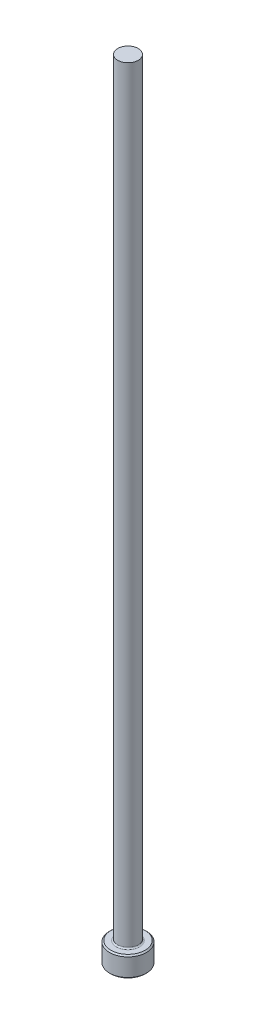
SolidWorks part; units mm, degrees
ref_plane "Front Plane" through (0, 0, 0) normal (0, 0, 1) x (1, 0, 0)
ref_plane "Top Plane" through (0, 0, 0) normal (0, 1, 0) x (1, 0, 0)
ref_plane "Right Plane" through (0, 0, 0) normal (1, 0, 0) x (0, 0, -1)
sketch "Sketch1" plane through (0, 0, 0) normal (0, 0, 1) x (1, 0, 0)
  line L0 (0, 259.9588) -> (0, -15.1925) construction
  line L1 (0, 0) -> (-3.5687, 0)
  line L2 (-3.5687, 0) -> (-3.5687, 3.9624)
  line L3 (-3.5687, 3.9624) -> (-1.9837, 3.9624)
  line L4 (-1.9837, 3.9624) -> (-1.9837, 152.4)
  line L5 (-1.9837, 152.4) -> (0, 152.4)
  line L6 (0, 152.4) -> (0, 0)
  dimension "L" = 152.4
  dimension "H" = 7.1374
  dimension "T" = 3.9624
  dimension "D" = 3.9675
revolve "Revolve1" add sketch "Sketch1" angle 360 about L0
chamfer "Chamfer1" distance 0.254 angle 45 2 edges at (0, 3.9624, 3.5687) (0, 0, 3.5687)
fillet "Fillet1" radius 0.254 1 edges at (0, 3.9624, 1.9837)
sketch "Pocket Sketch" plane through (0, 0, 0) normal (0, 0, 1) x (1, 0, 0)
  line L0 (-3.9656, 0) -> (-3.9656, 3.9878)
  line L1 (-3.9656, 3.9878) -> (-2.9442, 3.9878)
  line L2 (-2.1822, 4.7498) -> (-2.1822, 22.225)
  line L3 (-2.1822, 22.225) -> (0, 22.225)
  line L4 (0, 22.225) -> (0, 0)
  line L5 (0, 0) -> (-3.9656, 0)
  line L6 (0, 12.6104) -> (0, -2.4989) construction
  line L7 (-3.5687, 3.7084) -> (-3.5687, 0.254) construction
  line L8 (3.3147, 3.9624) -> (-3.3147, 3.9624) construction
  line L9 (-1.9837, 152.4) -> (-1.9837, 4.2164) construction
  line L10 (-2.9442, 3.9878) -> (-2.1822, 4.7498)
  point P3 (-2.1822, 3.9878)
  dimension "D1" = 7.9311
  dimension "D2" = 0.3969
  dimension "D3" = 0.0254
  dimension "D4" = 0.1984
  dimension "D5" = 4.3644
  dimension "D6" = 22.225
